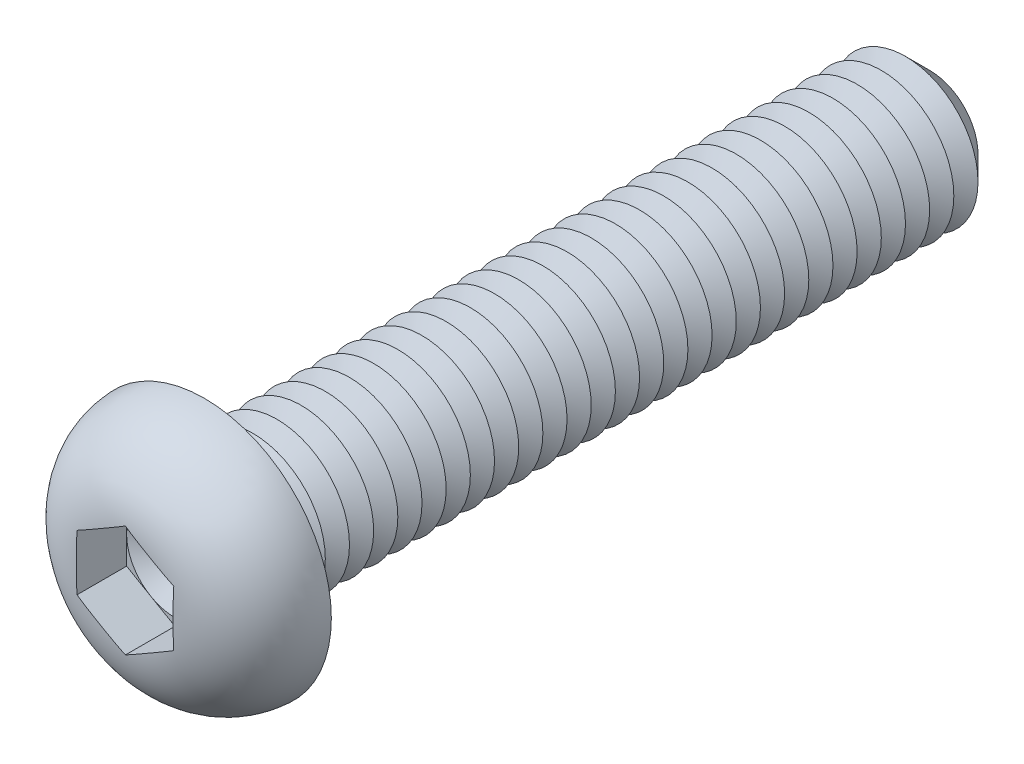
SolidWorks part; units mm, degrees
ref_plane "Front Plane" through (0, 0, 0) normal (0, 0, 1) x (1, 0, 0)
ref_plane "Top Plane" through (0, 0, 0) normal (0, 1, 0) x (1, 0, 0)
ref_plane "Right Plane" through (0, 0, 0) normal (1, 0, 0) x (0, 0, -1)
sketch "Sketch1" plane through (0, 0, 0) normal (1, 0, 0) x (0, 0, -1)
  line L0 (-47.9342, 0) -> (60.3146, 0) construction
sketch "Sketch2" plane through (0, 0, 0) normal (1, 0, 0) x (0, 0, -1)
  line L0 (0, 0) -> (-3.3, 0)
  line L1 (-47.9342, 0) -> (60.3146, 0) construction
  line L2 (-3.3, 0) -> (-3.3, 1.8515)
  line L3 (0, 5.25) -> (0, 0)
  arc A0 (-3.3, 1.8515) -> (0, 5.25) centre (0.1, 1.8515) cw
  dimension "D1" = 3.4
  dimension "D2" = 3.3
  dimension "D3" = 5.25
revolve "Revolve1" add sketch "Sketch2" angle 360 about L0
sketch "Sketch3" plane through (0, 0, 3.3) normal (0, 0, 1) x (1, 0, 0)
  line L1 (0, 2.3094) -> (-2, 1.1547)
  line L2 (-2, 1.1547) -> (-2, -1.1547)
  line L3 (-2, -1.1547) -> (0, -2.3094)
  line L4 (0, -2.3094) -> (2, -1.1547)
  line L5 (2, -1.1547) -> (2, 1.1547)
  line L6 (2, 1.1547) -> (0, 2.3094)
  circle A0 centre (0, 0) radius 2 construction
  dimension "D1" = 4
extrude "Cut-Extrude1" cut sketch "Sketch3" against normal blind 2.08
sketch "Sketch4" plane through (0, 0, 0) normal (0, 0, -1) x (-1, 0, 0)
  circle A0 centre (0, 0) radius 3
  dimension "D1" = 6
extrude "Boss-Extrude1" add sketch "Sketch4" along normal blind 30
chamfer "Chamfer1" distance 1 angle 45 1 edges at (-3, 0, -30)
sketch "Sketch5" plane through (0, 0, 0) normal (1, 0, 0) x (0, 0, -1)
  line L0 (1, 3) -> (2, 3)
  line L1 (29, 3) -> (0, 3) construction
  line L2 (2, 3) -> (1.5, 2.134)
  line L3 (1.5, 2.134) -> (1, 3)
  line L4 (0, -5.25) -> (0, 5.25) construction
  line L5 (29, 3) -> (0, 3) construction
  dimension "D1" = 1
  dimension "D2" = 1
revolve "Cut-Revolve1" cut sketch "Sketch5" angle 360 about L0
pattern_linear "LPattern1" count 28 spacing 1 along (0, 0, -1) of "Cut-Revolve1"
fillet "Fillet2" radius 0.5 1 edges at (-3, 0, 0)
sketch "Sketch6" plane through (0, 0, 1.22) normal (0, 0, 1) x (1, 0, 0)
  line L0 (0, -2.3094) -> (2, -1.1547) construction
  circle A0 centre (0, 0) radius 2
extrude "Cut-Extrude2" cut sketch "Sketch6" against normal through all draft 60
